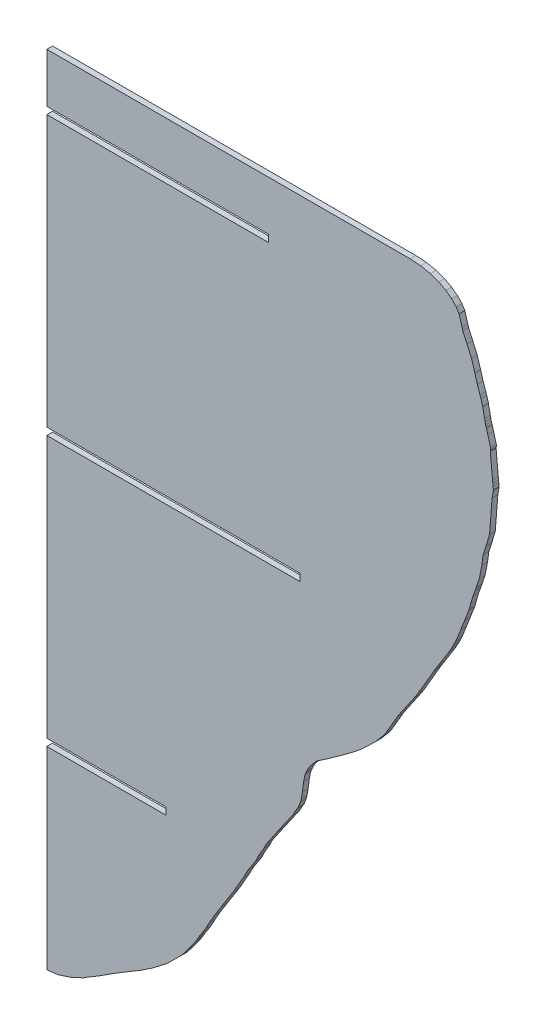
SolidWorks part; units mm, degrees
ref_plane "Спереди" through (0, 0, 0) normal (0, 0, 1) x (1, 0, 0)
ref_plane "Сверху" through (0, 0, 0) normal (0, 1, 0) x (1, 0, 0)
ref_plane "Справа" through (0, 0, 0) normal (1, 0, 0) x (0, 0, -1)
sketch "Model" plane through (0, 0, 0) normal (0, 0, 1) x (1, 0, 0)
  line L0 (-5408.4533, -53.9262) -> (-5408.463, -53.9437)
  line L1 (-5408.463, -53.9437) -> (-5408.4718, -53.9596)
  line L2 (-5408.4718, -53.9596) -> (-5408.4806, -53.9755)
  line L3 (-5408.4806, -53.9755) -> (-5408.4894, -53.9913)
  line L4 (-5408.4894, -53.9913) -> (-5409.1195, -54.9242)
  line L5 (-5409.1195, -54.9242) -> (-5410.8983, -57.4753)
  line L6 (-5410.8983, -57.4753) -> (-5410.9894, -57.5922)
  line L7 (-5410.9894, -57.5922) -> (-5411.0807, -57.709)
  line L8 (-5411.0807, -57.709) -> (-5413.3844, -60.7014)
  line L9 (-5413.3844, -60.7014) -> (-5414.0084, -61.4408)
  line L10 (-5414.0084, -61.4408) -> (-5414.024, -61.4565)
  line L11 (-5414.024, -61.4565) -> (-5414.0294, -61.4617)
  line L12 (-5414.0294, -61.4617) -> (-5414.0685, -61.5079)
  line L13 (-5414.0685, -61.5079) -> (-5414.8509, -62.2709)
  line L14 (-5414.8509, -62.2709) -> (-5418.4608, -65.8267)
  line L15 (-5418.4608, -65.8267) -> (-5418.8163, -66.1727)
  line L16 (-5418.8163, -66.1727) -> (-5419.3741, -66.633)
  line L17 (-5419.3741, -66.633) -> (-5420.2789, -67.3157)
  line L18 (-5420.2789, -67.3157) -> (-5423.8468, -70.0482)
  line L19 (-5423.8468, -70.0482) -> (-5424.1168, -70.2341)
  line L20 (-5424.1168, -70.2341) -> (-5424.3868, -70.4199)
  line L21 (-5424.3868, -70.4199) -> (-5424.9066, -70.7563)
  line L22 (-5424.9066, -70.7563) -> (-5428.1244, -72.8907)
  line L23 (-5428.1244, -72.8907) -> (-5432.2049, -75.3166)
  line L24 (-5432.2049, -75.3166) -> (-5437.9562, -78.8179)
  line L25 (-5437.9562, -78.8179) -> (-5442.8224, -81.9632)
  line L26 (-5446.2811, -84.0007) -> (-5442.8224, -81.9632)
  line L27 (-5372.4449, 74.9255) -> (-5372.4449, 72.4255)
  line L28 (-5372.4449, 74.9255) -> (-5460.7386, 74.9255)
  line L29 (-5460.7386, 72.4255) -> (-5372.4449, 72.4255)
  line L38 (-5446.2811, -84.0007) -> (-5448.3084, -85.2973)
  line L39 (-5448.3084, -85.2973) -> (-5448.5687, -85.3841)
  line L40 (-5448.5687, -85.3841) -> (-5448.829, -85.471)
  line L41 (-5448.829, -85.471) -> (-5451.6651, -86.8804)
  line L42 (-5451.6651, -86.8804) -> (-5451.7237, -86.9102)
  line L43 (-5451.7237, -86.9102) -> (-5451.7826, -86.9399)
  line L44 (-5451.7826, -86.9399) -> (-5452.0123, -87.0112)
  line L45 (-5452.0123, -87.0112) -> (-5452.242, -87.0825)
  line L46 (-5452.242, -87.0825) -> (-5453.0887, -87.3597)
  line L47 (-5453.0887, -87.3597) -> (-5456.7367, -88.5353)
  line L48 (-5456.7367, -88.5353) -> (-5457.742, -88.7161)
  line L49 (-5457.742, -88.7161) -> (-5458.4408, -88.7665)
  line L50 (-5458.4408, -88.7665) -> (-5460.7386, -89.0461)
  line L51 (-5460.7386, -89.0461) -> (-5460.7386, -21.5439)
  line L52 (-5460.7386, -21.5439) -> (-5419.2267, -21.5439)
  line L53 (-5419.2267, -21.5439) -> (-5419.2267, -21.2939)
  line L54 (-5419.2267, -21.2939) -> (-5419.2267, -19.2939)
  line L55 (-5419.2267, -19.2939) -> (-5419.2267, -19.0439)
  line L56 (-5419.2267, -19.0439) -> (-5460.7386, -19.0439)
  line L57 (-5460.7386, -19.0439) -> (-5460.7386, 72.4255)
  line L63 (-5460.7386, 74.9255) -> (-5460.7386, 169.3754)
  line L64 (-5460.7386, 169.3754) -> (-5383.3607, 169.3754)
  line L65 (-5383.3607, 169.3754) -> (-5383.3607, 169.6028)
  line L66 (-5383.3607, 169.6028) -> (-5383.3607, 171.6028)
  line L67 (-5383.3607, 171.6028) -> (-5383.3607, 171.8754)
  line L68 (-5383.3607, 171.8754) -> (-5460.7386, 171.8754)
  line L69 (-5460.7386, 171.8754) -> (-5460.7386, 189.083)
  line L70 (-5460.7386, 189.083) -> (-5333.9532, 189.1549)
  line L71 (-5333.9532, 189.1549) -> (-5330.2684, 188.9062)
  line L72 (-5330.2684, 188.9062) -> (-5326.9486, 188.2157)
  line L73 (-5326.9486, 188.2157) -> (-5324.0255, 187.1674)
  line L74 (-5324.0255, 187.1674) -> (-5321.5304, 185.845)
  line L75 (-5321.5304, 185.845) -> (-5319.4945, 184.3322)
  line L76 (-5319.4945, 184.3322) -> (-5317.9493, 182.7128)
  line L77 (-5317.9493, 182.7128) -> (-5316.9264, 181.0705)
  line L78 (-5316.9264, 181.0705) -> (-5315.868, 177.5103)
  line L79 (-5315.868, 177.5103) -> (-5315.6253, 176.5949)
  line L80 (-5315.6253, 176.5949) -> (-5314.1493, 173.3449)
  line L81 (-5314.1493, 173.3449) -> (-5312.5677, 169.7051)
  line L82 (-5312.5677, 169.7051) -> (-5311.4491, 166.0962)
  line L83 (-5311.4491, 166.0962) -> (-5311.4469, 166.0885)
  line L84 (-5311.4469, 166.0885) -> (-5311.4447, 166.0808)
  line L85 (-5311.4447, 166.0808) -> (-5311.4427, 166.0731)
  line L86 (-5311.4427, 166.0731) -> (-5311.4405, 166.0655)
  line L87 (-5311.4405, 166.0655) -> (-5311.3573, 165.8047)
  line L88 (-5311.3573, 165.8047) -> (-5310.5423, 162.9632)
  line L89 (-5310.5423, 162.9632) -> (-5309.6183, 160.2642)
  line L90 (-5309.6183, 160.2642) -> (-5309.2857, 159.3144)
  line L91 (-5309.2857, 159.3144) -> (-5308.7003, 157.3245)
  line L92 (-5308.7003, 157.3245) -> (-5308.6732, 157.1728)
  line L93 (-5308.6732, 157.1728) -> (-5308.6458, 157.021)
  line L94 (-5308.6458, 157.021) -> (-5308.013, 153.854)
  line L95 (-5308.013, 153.854) -> (-5307.8294, 152.9604)
  line L96 (-5307.8294, 152.9604) -> (-5307.6456, 152.0666)
  line L97 (-5307.6456, 152.0666) -> (-5307.4442, 151.5232)
  line L98 (-5307.4442, 151.5232) -> (-5307.4205, 151.4395)
  line L99 (-5307.4205, 151.4395) -> (-5307.3968, 151.3558)
  line L100 (-5307.3968, 151.3558) -> (-5307.3624, 151.2614)
  line L101 (-5307.3624, 151.2614) -> (-5307.3277, 151.167)
  line L102 (-5307.3277, 151.167) -> (-5306.8912, 149.5739)
  line L103 (-5306.8912, 149.5739) -> (-5305.9496, 146.2538)
  line L104 (-5305.9496, 146.2538) -> (-5305.9352, 145.953)
  line L105 (-5305.9352, 145.953) -> (-5305.9208, 145.6523)
  line L106 (-5305.9208, 145.6523) -> (-5305.921, 145.6505)
  line L107 (-5305.921, 145.6505) -> (-5305.9212, 145.6487)
  line L108 (-5305.9212, 145.6487) -> (-5305.9168, 145.5624)
  line L109 (-5305.9168, 145.5624) -> (-5306.0165, 144.9763)
  line L110 (-5306.0165, 144.9763) -> (-5305.2481, 136.7716)
  line L111 (-5305.2481, 136.7716) -> (-5305.1539, 135.7981)
  line L112 (-5305.1539, 135.7981) -> (-5305.0594, 134.8245)
  line L113 (-5305.0594, 134.8245) -> (-5304.9298, 133.8442)
  line L114 (-5304.9298, 133.8442) -> (-5304.9308, 133.8384)
  line L115 (-5304.9308, 133.8384) -> (-5304.9312, 133.8355)
  line L116 (-5304.9312, 133.8355) -> (-5304.932, 133.8326)
  line L117 (-5304.932, 133.8326) -> (-5304.9315, 133.8288)
  line L118 (-5304.9315, 133.8288) -> (-5304.9308, 133.8249)
  line L119 (-5304.9308, 133.8249) -> (-5304.9298, 133.8172)
  line L120 (-5304.9298, 133.8172) -> (-5305.3985, 131.1886)
  line L121 (-5305.3985, 131.1886) -> (-5306.2677, 119.8442)
  line L122 (-5306.2677, 119.8442) -> (-5307.5025, 115.5524)
  line L123 (-5307.5025, 115.5524) -> (-5308.5406, 112.4017)
  line L124 (-5308.5406, 112.4017) -> (-5308.9669, 109.0915)
  line L125 (-5308.9669, 109.0915) -> (-5309.8622, 104.5376)
  line L126 (-5309.8622, 104.5376) -> (-5310.8717, 101.5689)
  line L127 (-5310.8717, 101.5689) -> (-5311.0902, 100.9117)
  line L128 (-5311.0902, 100.9117) -> (-5311.3089, 100.2546)
  line L129 (-5311.3089, 100.2546) -> (-5312.1192, 98.0953)
  line L130 (-5312.1192, 98.0953) -> (-5312.8839, 95.3962)
  line L131 (-5312.8839, 95.3962) -> (-5313.099, 94.5842)
  line L132 (-5313.099, 94.5842) -> (-5313.3141, 93.7722)
  line L133 (-5313.3141, 93.7722) -> (-5313.3697, 93.6278)
  line L134 (-5313.3697, 93.6278) -> (-5313.4256, 93.4833)
  line L135 (-5313.4256, 93.4833) -> (-5313.452, 93.39)
  line L136 (-5313.452, 93.39) -> (-5313.4784, 93.2968)
  line L137 (-5313.4784, 93.2968) -> (-5314.9654, 89.4489)
  line L138 (-5314.9654, 89.4489) -> (-5316.4195, 85.7405)
  line L139 (-5316.4195, 85.7405) -> (-5317.7162, 82.393)
  line L140 (-5317.7162, 82.393) -> (-5318.3084, 81.1741)
  line L141 (-5318.3084, 81.1741) -> (-5318.8653, 79.9984)
  line L142 (-5318.8653, 79.9984) -> (-5319.5746, 78.6669)
  line L143 (-5319.5746, 78.6669) -> (-5320.412, 77.197)
  line L144 (-5320.412, 77.197) -> (-5320.4183, 77.1868)
  line L145 (-5320.4183, 77.1868) -> (-5320.4247, 77.1766)
  line L146 (-5320.4247, 77.1766) -> (-5320.441, 77.1477)
  line L147 (-5320.441, 77.1477) -> (-5320.4574, 77.1188)
  line L148 (-5320.4574, 77.1188) -> (-5323.8727, 71.6995)
  line L149 (-5323.8727, 71.6995) -> (-5324.6659, 70.4396)
  line L150 (-5324.6659, 70.4396) -> (-5324.8832, 70.103)
  line L151 (-5324.8832, 70.103) -> (-5325.1004, 69.7664)
  line L152 (-5325.1004, 69.7664) -> (-5325.2906, 69.4369)
  line L153 (-5325.2906, 69.4369) -> (-5325.4811, 69.1074)
  line L154 (-5325.4811, 69.1074) -> (-5331.1903, 59.3462)
  line L155 (-5331.1903, 59.3462) -> (-5332.3253, 57.5837)
  line L156 (-5332.3253, 57.5837) -> (-5332.3282, 57.5794)
  line L157 (-5332.3282, 57.5794) -> (-5332.3338, 57.5706)
  line L158 (-5332.3338, 57.5706) -> (-5332.3397, 57.5619)
  line L159 (-5332.3397, 57.5619) -> (-5332.3509, 57.5444)
  line L160 (-5332.3509, 57.5444) -> (-5332.5057, 57.3196)
  line L161 (-5332.5057, 57.3196) -> (-5332.5575, 57.2446)
  line L162 (-5332.5575, 57.2446) -> (-5338.3238, 48.8214)
  line L163 (-5338.3238, 48.8214) -> (-5338.4771, 48.5474)
  line L164 (-5338.4771, 48.5474) -> (-5338.6305, 48.2733)
  line L165 (-5338.6305, 48.2733) -> (-5340.0233, 45.8617)
  line L166 (-5340.0233, 45.8617) -> (-5342.4859, 41.6596)
  line L167 (-5342.4859, 41.6596) -> (-5342.9254, 40.9603)
  line L168 (-5342.9254, 40.9603) -> (-5343.3731, 40.4037)
  line L169 (-5343.3731, 40.4037) -> (-5345.9649, 37.3416)
  line L170 (-5345.9649, 37.3416) -> (-5348.4715, 34.9072)
  line L171 (-5348.4715, 34.9072) -> (-5351.4029, 32.173)
  line L172 (-5351.4029, 32.173) -> (-5354.1385, 29.9819)
  line L173 (-5354.1385, 29.9819) -> (-5357.098, 27.7893)
  line L174 (-5357.098, 27.7893) -> (-5357.2799, 27.6466)
  line L175 (-5357.2799, 27.6466) -> (-5357.462, 27.5196)
  line L176 (-5357.462, 27.5196) -> (-5358.0538, 27.0812)
  line L177 (-5358.0538, 27.0812) -> (-5363.5501, 23.1794)
  line L178 (-5363.5501, 23.1794) -> (-5366.389, 21.2743)
  line L179 (-5366.389, 21.2743) -> (-5366.9491, 20.6846)
  line L180 (-5366.9491, 20.6846) -> (-5369.026, 18.3012)
  line L181 (-5369.026, 18.3012) -> (-5370.0636, 16.3315)
  line L182 (-5370.0636, 16.3315) -> (-5370.3729, 15.6387)
  line L183 (-5370.3729, 15.6387) -> (-5370.6822, 14.9458)
  line L184 (-5370.6822, 14.9458) -> (-5371.1605, 12.5537)
  line L185 (-5371.1605, 12.5537) -> (-5371.5916, 9.1919)
  line L186 (-5371.5916, 9.1919) -> (-5371.9801, 6.8961)
  line L187 (-5371.9801, 6.8961) -> (-5372.2298, 5.9779)
  line L188 (-5372.2298, 5.9779) -> (-5373.0055, 3.9587)
  line L189 (-5373.0055, 3.9587) -> (-5373.2813, 3.5076)
  line L190 (-5373.2813, 3.5076) -> (-5373.5575, 3.0564)
  line L191 (-5373.5575, 3.0564) -> (-5374.7357, 0.943)
  line L192 (-5374.7357, 0.943) -> (-5379.7845, -6.2948)
  line L193 (-5379.7845, -6.2948) -> (-5380.3265, -7.0549)
  line L194 (-5380.3265, -7.0549) -> (-5380.3746, -7.1404)
  line L195 (-5380.3746, -7.1404) -> (-5380.4227, -7.2257)
  line L196 (-5380.4227, -7.2257) -> (-5384.2474, -12.818)
  line L197 (-5384.2474, -12.818) -> (-5384.6278, -13.6564)
  line L198 (-5384.6278, -13.6564) -> (-5385.055, -14.5616)
  line L199 (-5385.055, -14.5616) -> (-5386.9828, -17.8335)
  line L200 (-5386.9828, -17.8335) -> (-5387.347, -18.642)
  line L201 (-5387.347, -18.642) -> (-5387.7113, -19.4503)
  line L202 (-5387.7113, -19.4503) -> (-5389.7955, -22.6691)
  line L203 (-5389.7955, -22.6691) -> (-5390.4735, -23.6866)
  line L204 (-5390.4735, -23.6866) -> (-5392.1175, -26.7395)
  line L205 (-5392.1175, -26.7395) -> (-5395.6153, -32.8334)
  line L206 (-5395.6153, -32.8334) -> (-5399.7254, -39.3247)
  line L207 (-5399.7254, -39.3247) -> (-5402.4117, -43.6007)
  line L208 (-5402.4117, -43.6007) -> (-5403.8741, -46.1775)
  line L209 (-5403.8741, -46.1775) -> (-5405.4017, -48.9737)
  line L210 (-5405.4017, -48.9737) -> (-5406.4737, -50.7237)
  line L211 (-5406.4737, -50.7237) -> (-5406.4796, -50.7322)
  line L212 (-5406.4796, -50.7322) -> (-5406.4854, -50.7406)
  line L213 (-5406.4854, -50.7406) -> (-5406.4911, -50.749)
  line L214 (-5406.4911, -50.749) -> (-5406.4969, -50.7574)
  line L215 (-5406.4969, -50.7574) -> (-5406.5045, -50.7698)
  line L216 (-5406.5045, -50.7698) -> (-5406.5121, -50.7822)
  line L217 (-5406.5121, -50.7822) -> (-5406.5194, -50.7945)
  line L218 (-5406.5194, -50.7945) -> (-5406.527, -50.8069)
  line L219 (-5406.527, -50.8069) -> (-5406.9786, -51.4635)
  line L220 (-5406.9786, -51.4635) -> (-5407.4303, -52.1201)
  line L221 (-5407.4303, -52.1201) -> (-5407.704, -52.5909)
  line L222 (-5407.704, -52.5909) -> (-5407.9779, -53.0617)
  line L223 (-5407.9779, -53.0617) -> (-5408.1908, -53.4486)
  line L224 (-5408.1908, -53.4486) -> (-5408.4037, -53.8356)
  line L225 (-5408.4037, -53.8356) -> (-5408.4156, -53.8578)
  line L226 (-5408.4156, -53.8578) -> (-5408.4278, -53.8801)
  line L227 (-5408.4278, -53.8801) -> (-5408.44, -53.9023)
  line L228 (-5408.44, -53.9023) -> (-5408.4533, -53.9262)
extrude "Бобышка-Вытянуть1" add sketch "Model" along normal blind 2
